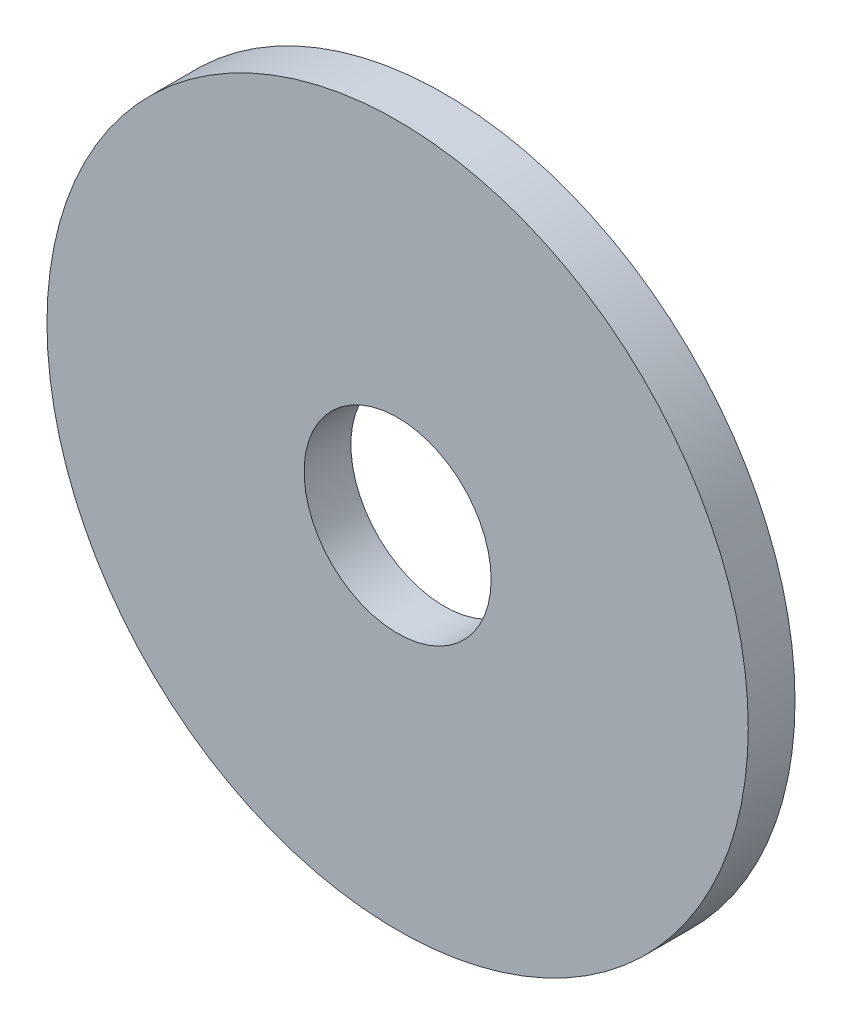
SolidWorks part; units mm, degrees
ref_plane "Plan de face" through (0, 0, 0) normal (0, 0, 1) x (1, 0, 0)
ref_plane "Plan de dessus" through (0, 0, 0) normal (0, 1, 0) x (1, 0, 0)
ref_plane "Plan de droite" through (0, 0, 0) normal (1, 0, 0) x (0, 0, -1)
sketch "Esquisse1" plane through (0, 0, 0) normal (0, 0, 1) x (1, 0, 0)
  circle A0 centre (0, 0) radius 6
  circle A1 centre (0, 0) radius 1.6
extrude "Extrusion1" add sketch "Esquisse1" along normal blind 0.8
